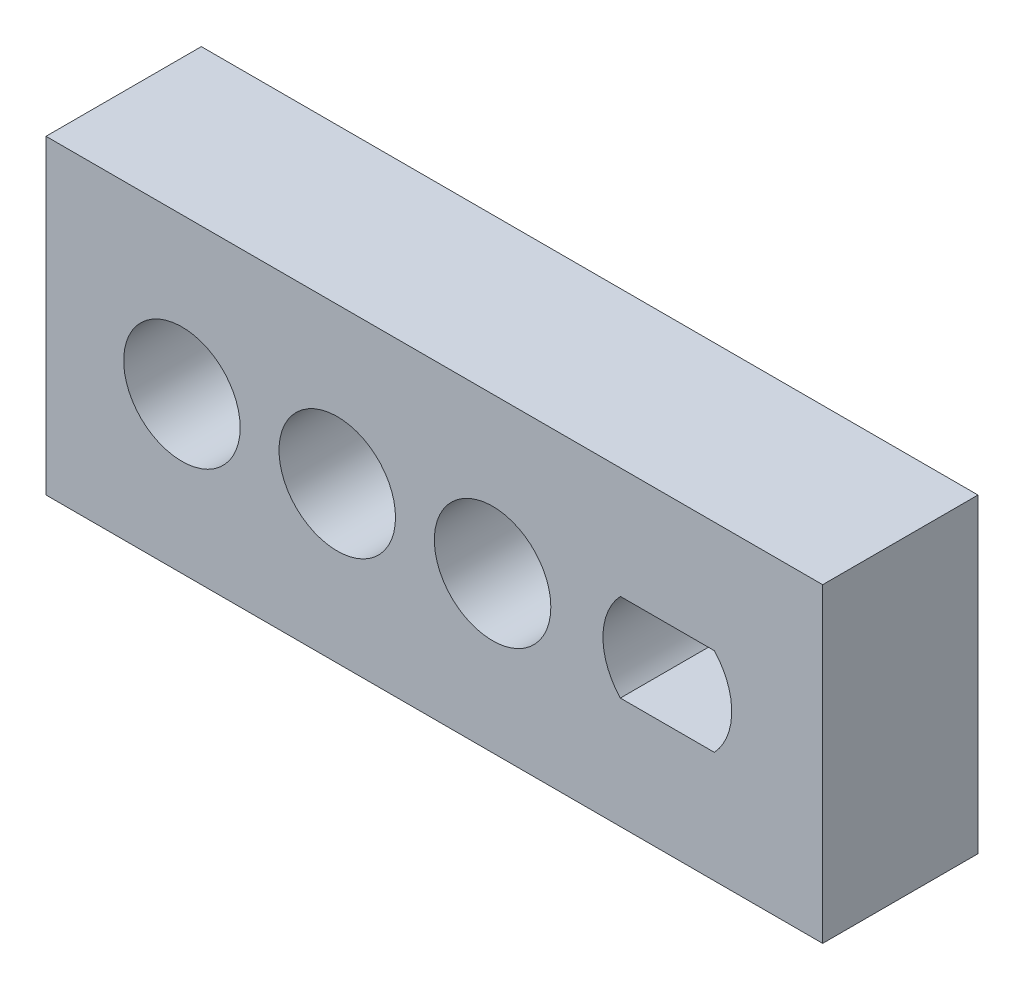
SolidWorks part; units mm, degrees
ref_plane "Front Plane" through (0, 0, 0) normal (0, 0, 1) x (1, 0, 0)
ref_plane "Top Plane" through (0, 0, 0) normal (0, 1, 0) x (1, 0, 0)
ref_plane "Right Plane" through (0, 0, 0) normal (1, 0, 0) x (0, 0, -1)
sketch "Sketch1" plane through (0, 0, 0) normal (0, 0, 1) x (1, 0, 0)
  line L1 (-110.141, 50.4924) -> (16.859, 50.4924)
  line L2 (-110.141, 50.4924) -> (-110.141, -0.3076)
  line L3 (-110.141, -0.3076) -> (16.859, -0.3076)
  line L4 (16.859, 50.4924) -> (16.859, -0.3076)
  line L5 (-8.541, 32.2902) -> (-0.8575, 32.2902)
  line L6 (-0.8575, 17.8945) -> (-8.541, 17.8945)
  line L7 (-8.541, 17.8945) -> (-16.2245, 17.8945)
  line L8 (-8.541, 32.2902) -> (-16.2245, 32.2902)
  arc A0 (-16.2245, 32.2902) -> (-16.2245, 17.8945) centre (-8.541, 25.0924) ccw
  circle A1 centre (-37.116, 25.0924) radius 9.525
  arc A2 (-0.8575, 17.8945) -> (-0.8575, 32.2902) centre (-8.541, 25.0924) ccw
  circle A3 centre (-62.516, 25.0924) radius 9.525
  circle A4 centre (-87.916, 25.0924) radius 9.525
  dimension "D3" = 21.0566
  dimension "D6" = 19.05
  dimension "D10" = 19.05
  dimension "D11" = 15.367
  dimension "D8" = 19.05
  dimension "D1" = 50.8
  dimension "D2" = 127
  dimension "D4" = 25.4
  dimension "D5" = 25.4
  dimension "D7" = 28.575
  dimension "D9" = 25.4
  dimension "D12" = 15.367
  dimension "D13" = 25.4
extrude "Extrude1" add sketch "Sketch1" along normal blind 25.4
